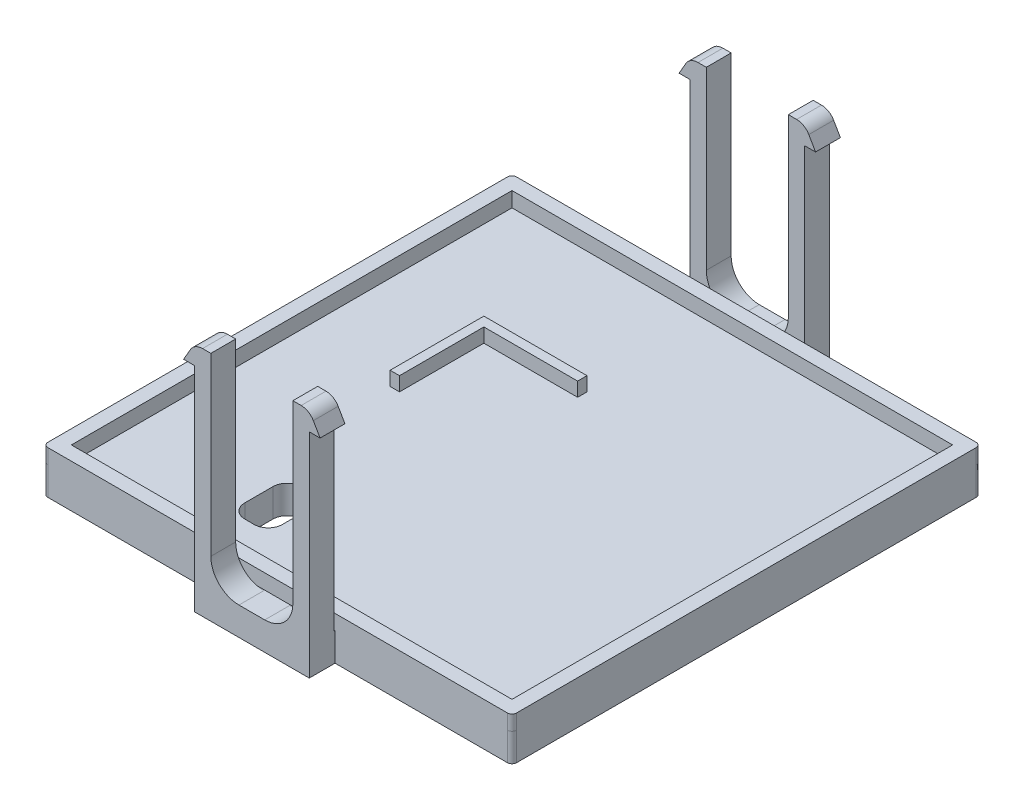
SolidWorks part; units mm, degrees
ref_plane "Front Plane" through (0, 0, 0) normal (0, 0, 1) x (1, 0, 0)
ref_plane "Top Plane" through (0, 0, 0) normal (0, 1, 0) x (1, 0, 0)
ref_plane "Right Plane" through (0, 0, 0) normal (1, 0, 0) x (0, 0, -1)
sketch "Sketch1" plane through (0, 0, 0) normal (0, 1, 0) x (1, 0, 0)
  line L0 (-33.5, 31) -> (33.5, 31) construction
  line L1 (-32.5, 30) -> (32.5, 30) construction
  line L2 (-32.5, 30) -> (-32.5, -30) construction
  line L3 (-32.5, -30) -> (32.5, -30) construction
  line L4 (32.5, 30) -> (32.5, -30) construction
  line L5 (-32.5, 30) -> (32.5, -30) construction
  line L6 (-32.5, -30) -> (32.5, 30) construction
  line L7 (33.5, 31) -> (33.5, -31) construction
  line L8 (-33.5, -31) -> (33.5, -31) construction
  line L9 (-33.5, 31) -> (-33.5, -31) construction
  line L10 (-36.5, 34) -> (36.5, 34)
  line L11 (36.5, 34) -> (36.5, -34)
  line L12 (-36.5, -34) -> (36.5, -34)
  line L13 (-36.5, 34) -> (-36.5, -34)
  point P0 (0, 0)
  dimension "D1" = 65
  dimension "D2" = 60
  dimension "D3" = 1
  dimension "D4" = 3
extrude "Boss-Extrude1" add sketch "Sketch1" along normal blind 20
sketch "Sketch2" plane through (0, 20, 0) normal (0, 1, 0) x (1, 0, 0)
  line L0 (36.5, 34) -> (-36.5, 34) construction
  line L1 (-33.5, 31) -> (33.5, 31)
  line L2 (-33.5, 31) -> (-33.5, -31)
  line L3 (-33.5, -31) -> (33.5, -31)
  line L4 (33.5, 31) -> (33.5, -31)
  line L5 (-33.5, 31) -> (33.5, -31) construction
  line L6 (-33.5, -31) -> (33.5, 31) construction
  line L7 (-36.5, 34) -> (-36.5, -34) construction
  point P0 (0, 0)
  dimension "D1" = 3
  dimension "D2" = 3
extrude "Cut-Extrude1" cut sketch "Sketch2" against normal blind 20
sketch "Sketch3" plane through (0, 0, 0) normal (0, -1, 0) x (1, 0, 0)
  line L1 (-50, 50) -> (50, 50)
  line L2 (-50, 50) -> (-50, -50)
  line L3 (-50, -50) -> (50, -50)
  line L4 (50, 50) -> (50, -50)
  line L5 (-50, 50) -> (50, -50) construction
  line L6 (-50, -50) -> (50, 50) construction
  point P0 (0, 0)
  dimension "D1" = 100
  dimension "D2" = 100
extrude "Boss-Extrude2" add sketch "Sketch3" against normal blind 2
fillet "Fillet1" radius 1 4 edges at (-50, 1, -50) (50, 1, -50) (50, 1, 50) (-50, 1, 50)
sketch "Sketch4" plane through (0, 2, 0) normal (0, 1, 0) x (1, 0, 0)
  line L0 (0, 0) -> (0, 55.5) construction
  line L2 (-49, 50) -> (49, 50) construction
  line L3 (12.25, 55.5) -> (-12.25, 55.5)
  line L4 (12.25, 55.5) -> (12.25, 50)
  line L5 (12.25, 50) -> (-12.25, 50)
  line L6 (-12.25, 55.5) -> (-12.25, 50)
  line L7 (12.25, 55.5) -> (-12.25, 50) construction
  line L8 (12.25, 50) -> (-12.25, 55.5) construction
  point P3 (0, 52.75)
  dimension "D1" = 55.5
  dimension "D2" = 24.5
extrude "Boss-Extrude3" add sketch "Sketch4" against normal up to surface (2 mm away)
sketch "Sketch5" plane through (0, 0, -55.5) normal (0, 0, -1) x (-1, 0, 0)
  line L0 (-12.25, 2) -> (-12.25, 41.5)
  line L1 (-12.25, 41.5) -> (-14.5594, 41.5)
  line L2 (-14.5594, 41.5) -> (-13.116, 44)
  line L3 (-10.5179, 45.5) -> (-8.75, 45.5)
  line L4 (-8.75, 45.5) -> (-8.75, 2)
  line L5 (36.5, 2) -> (-36.5, 2) construction
  line L6 (-8.75, 2) -> (-12.25, 2)
  line L7 (0, 0) -> (0, 45.5) construction
  line L8 (12.25, 0) -> (-12.25, 0) construction
  line L9 (10.5179, 45.5) -> (8.75, 45.5)
  line L10 (8.75, 45.5) -> (8.75, 2)
  line L11 (8.75, 2) -> (12.25, 2)
  line L12 (14.5594, 41.5) -> (13.116, 44)
  line L13 (12.25, 41.5) -> (14.5594, 41.5)
  line L14 (12.25, 2) -> (12.25, 41.5)
  arc A0 (10.5179, 45.5) -> (13.116, 44) centre (10.5179, 42.5) cw
  arc A1 (-13.116, 44) -> (-10.5179, 45.5) centre (-10.5179, 42.5) cw
  point P3 (-8.75, 23.75)
  point P24 (12.25, 45.5)
  point P27 (-12.25, 45.5)
  dimension "D5" = 3
  dimension "D1" = 3.5
  dimension "D2" = 39.5
  dimension "D3" = 4
  dimension "D4" = 60
extrude "Boss-Extrude4" add sketch "Sketch5" against normal blind 5.3
fillet "Fillet2" radius 6 2 edges at (-8.75, 2, -52.85) (8.75, 2, -52.85)
mirror "Mirror1" about plane through (0, 0, 0) normal (0, 0, 1) of "Fillet2", "Boss-Extrude4", "Boss-Extrude3"
sketch "Sketch6" plane through (0, 2, 0) normal (0, 1, 0) x (1, 0, 0)
  line L0 (49, -50) -> (12.25, -50) construction
  line L1 (50, 49) -> (50, -49) construction
  line L2 (-50, -50) -> (50, -50)
  line L3 (-50, -49) -> (-50, 49) construction
  line L5 (49.7071, 49.7071) -> (-49.7071, -49.7071) construction
  line L6 (49.7071, -49.7071) -> (-49.7071, 49.7071) construction
  line L7 (-47, 47) -> (47, 47)
  line L8 (-47, 47) -> (-47, -47)
  line L9 (-47, -47) -> (47, -47)
  line L10 (47, 47) -> (47, -47)
  line L11 (-47, 47) -> (47, -47) construction
  line L12 (-47, -47) -> (47, 47) construction
  line L13 (-50, -50) -> (-50, 50)
  line L14 (-50, 50) -> (50, 50)
  line L15 (50, -50) -> (50, 50)
  line L16 (-50, -50) -> (50, 50) construction
  line L17 (-50, 50) -> (50, -50) construction
  arc A0 (-50, -49) -> (-49, -50) centre (-49, -49) ccw construction
  point P0 (0, 0)
  point P9 (0, 0)
  point P15 (0, 0)
  dimension "D1" = 3
extrude "Boss-Extrude5" add sketch "Sketch6" along normal blind 3.2
fillet "Fillet3" radius 1 4 edges at (-50, 3.6, 50) (-50, 3.6, -50) (50, 3.6, -50) (50, 3.6, 50)
sketch "Sketch7" plane through (36.5, 0, 0) normal (1, 0, 0) x (0, 0, -1)
  line L1 (-34, 2) -> (34, 2)
  line L2 (-34, 2) -> (-34, 20)
  line L3 (-34, 20) -> (34, 20)
  line L4 (34, 2) -> (34, 20)
extrude "Cut-Extrude2" cut sketch "Sketch7" against normal up to surface (73 mm away)
sketch "Sketch8" plane through (0, 2, 0) normal (0, 1, 0) x (1, 0, 0)
  line L0 (-27, 1) -> (-27, 21)
  line L1 (-27, 21) -> (-5, 21)
  line L2 (-5, 21) -> (-5, 19)
  line L3 (-5, 19) -> (-25, 19)
  line L4 (-25, 19) -> (-25, 1)
  line L5 (-25, 1) -> (-27, 1)
  line L6 (47, -47) -> (47, 47) construction
  line L7 (-47, -47) -> (47, -47) construction
  dimension "D1" = 2
  dimension "D2" = 2
  dimension "D3" = 72
  dimension "D4" = 66
  dimension "D5" = 20
  dimension "D6" = 20
extrude "Boss-Extrude6" add sketch "Sketch8" along normal blind 3
sketch "Sketch9" plane through (0, 2, 0) normal (0, 1, 0) x (1, 0, 0)
  line L0 (-25, 19) -> (-5, 19) construction
  line L1 (-18, -39) -> (-16, -39)
  line L2 (-21, -36) -> (-21, -30)
  line L3 (-18, -27) -> (-16, -27)
  line L4 (-13, -36) -> (-13, -30)
  line L5 (-25, 1) -> (-25, 19) construction
  arc A0 (-16, -39) -> (-13, -36) centre (-16, -36) ccw
  arc A1 (-16, -27) -> (-13, -30) centre (-16, -30) cw
  arc A2 (-21, -30) -> (-18, -27) centre (-18, -30) cw
  arc A3 (-18, -39) -> (-21, -36) centre (-18, -36) cw
  point P6 (-13, -33)
  point P13 (-13, -27)
  point P16 (-21, -27)
  dimension "D5" = 3
  dimension "D1" = 58
  dimension "D2" = 12
  dimension "D3" = 8
  dimension "D4" = 12
extrude "Cut-Extrude3" cut sketch "Sketch9" against normal blind 3
sketch "Sketch10" plane through (0, 0, 0) normal (0, -1, 0) x (1, 0, 0)
  line L0 (-18, 39) -> (-16, 39) construction
  line L1 (-13, 36) -> (-13, 30) construction
  line L2 (-16, 27) -> (-18, 27) construction
  line L3 (-21, 30) -> (-21, 36) construction
  line L4 (-18, 39) -> (-16, 39)
  line L5 (-13, 36) -> (-13, 30)
  line L6 (-16, 27) -> (-18, 27)
  line L7 (-21, 30) -> (-21, 36)
  line L12 (-50, 49) -> (-50, -49)
  line L13 (-49, -50) -> (-12.25, -50)
  line L14 (-12.25, -50) -> (-12.25, -55.5)
  line L15 (-12.25, -55.5) -> (12.25, -55.5)
  line L16 (12.25, -55.5) -> (12.25, -50)
  line L17 (12.25, -50) -> (49, -50)
  line L18 (50, -49) -> (50, 49)
  line L19 (49, 50) -> (12.25, 50)
  line L20 (12.25, 50) -> (12.25, 55.5)
  line L21 (12.25, 55.5) -> (-12.25, 55.5)
  line L22 (-12.25, 55.5) -> (-12.25, 50)
  line L23 (-12.25, 50) -> (-49, 50)
  line L24 (-50, 49) -> (-50, -49)
  line L25 (-49, -50) -> (-12.25, -50)
  line L26 (-12.25, -50) -> (-12.25, -55.5)
  line L27 (-12.25, -55.5) -> (12.25, -55.5)
  line L28 (12.25, -55.5) -> (12.25, -50)
  line L29 (12.25, -50) -> (49, -50)
  line L30 (50, -49) -> (50, 49)
  line L31 (49, 50) -> (12.25, 50)
  line L32 (12.25, 50) -> (12.25, 55.5)
  line L33 (12.25, 55.5) -> (-12.25, 55.5)
  line L34 (-12.25, 55.5) -> (-12.25, 50)
  line L35 (-12.25, 50) -> (-49, 50)
  arc A0 (-18, 39) -> (-21, 36) centre (-18, 36) ccw construction
  arc A1 (-13, 36) -> (-16, 39) centre (-16, 36) ccw construction
  arc A2 (-16, 27) -> (-13, 30) centre (-16, 30) ccw construction
  arc A3 (-21, 30) -> (-18, 27) centre (-18, 30) ccw construction
  arc A4 (-50, -49) -> (-49, -50) centre (-49, -49) ccw
  arc A5 (49, -50) -> (50, -49) centre (49, -49) ccw
  arc A6 (50, 49) -> (49, 50) centre (49, 49) ccw
  arc A7 (-49, 50) -> (-50, 49) centre (-49, 49) ccw
  arc A8 (-50, -49) -> (-49, -50) centre (-49, -49) ccw
  arc A9 (49, -50) -> (50, -49) centre (49, -49) ccw
  arc A10 (50, 49) -> (49, 50) centre (49, 49) ccw
  arc A11 (-49, 50) -> (-50, 49) centre (-49, 49) ccw
  arc A12 (-18, 39) -> (-21, 36) centre (-18, 36) ccw
  arc A13 (-13, 36) -> (-16, 39) centre (-16, 36) ccw
  arc A14 (-16, 27) -> (-13, 30) centre (-16, 30) ccw
  arc A15 (-21, 30) -> (-18, 27) centre (-18, 30) ccw
  dimension "D1" = 0
extrude "Boss-Extrude8" add sketch "Sketch10" along normal blind 4
